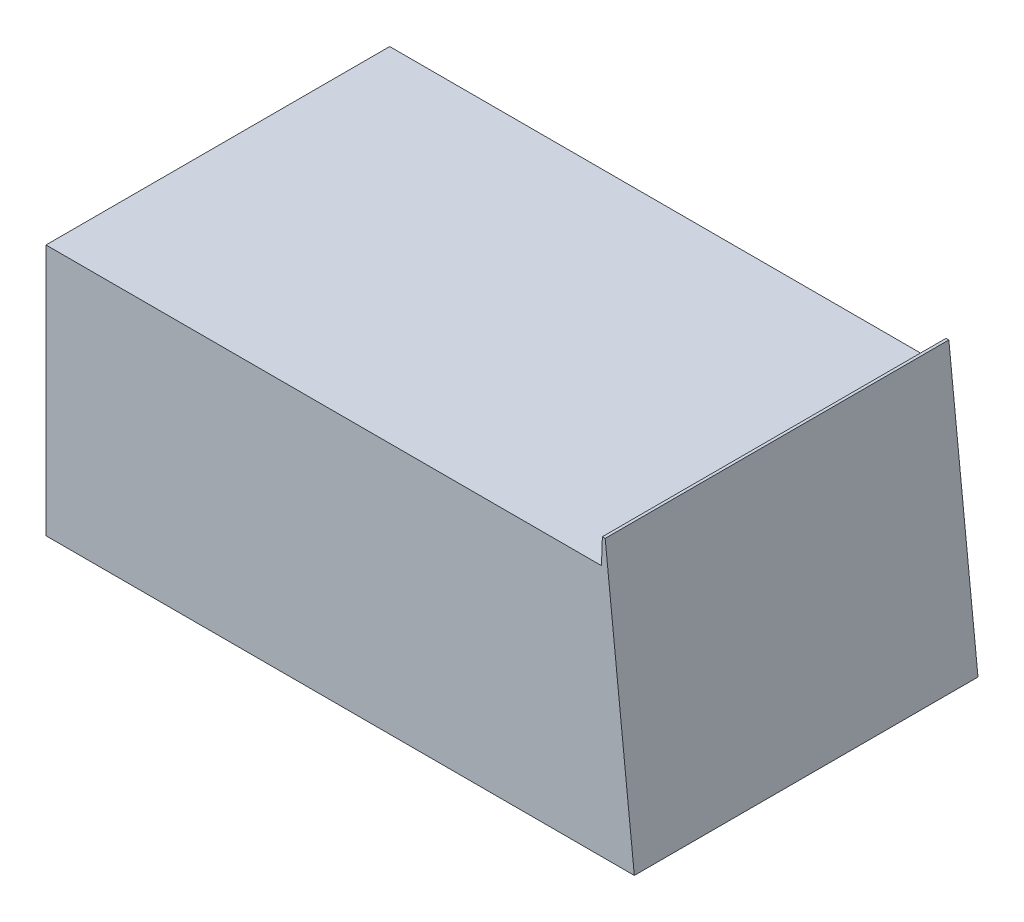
SolidWorks part; units mm, degrees
ref_plane "Front Plane" through (0, 0, 0) normal (0, 0, 1) x (1, 0, 0)
ref_plane "Top Plane" through (0, 0, 0) normal (0, 1, 0) x (1, 0, 0)
ref_plane "Right Plane" through (0, 0, 0) normal (1, 0, 0) x (0, 0, -1)
sketch "Sketch1" plane through (0, 0, 0) normal (0, 1, 0) x (1, 0, 0)
  line L1 (-71.738, 65.6679) -> (104.48, 65.6679)
  line L2 (-71.738, 65.6679) -> (-71.738, -42.1231)
  line L3 (-71.738, -42.1231) -> (104.48, -42.1231)
  line L4 (104.48, 65.6679) -> (104.48, -42.1231)
extrude "Boss-Extrude1" add sketch "Sketch1" along normal blind 79
draft "Draft1" type of draft neutral plane draft angle 6 faces to draft 1 parameters "D1"=6
other "Lip2" parameters "LipHeight"=8, "LipWidth"=2, "LipDraftAngle"=2, "D4"=0, "D5"=0, "D6"=12, "D7"=2, "D8"=2, "D9"=0
